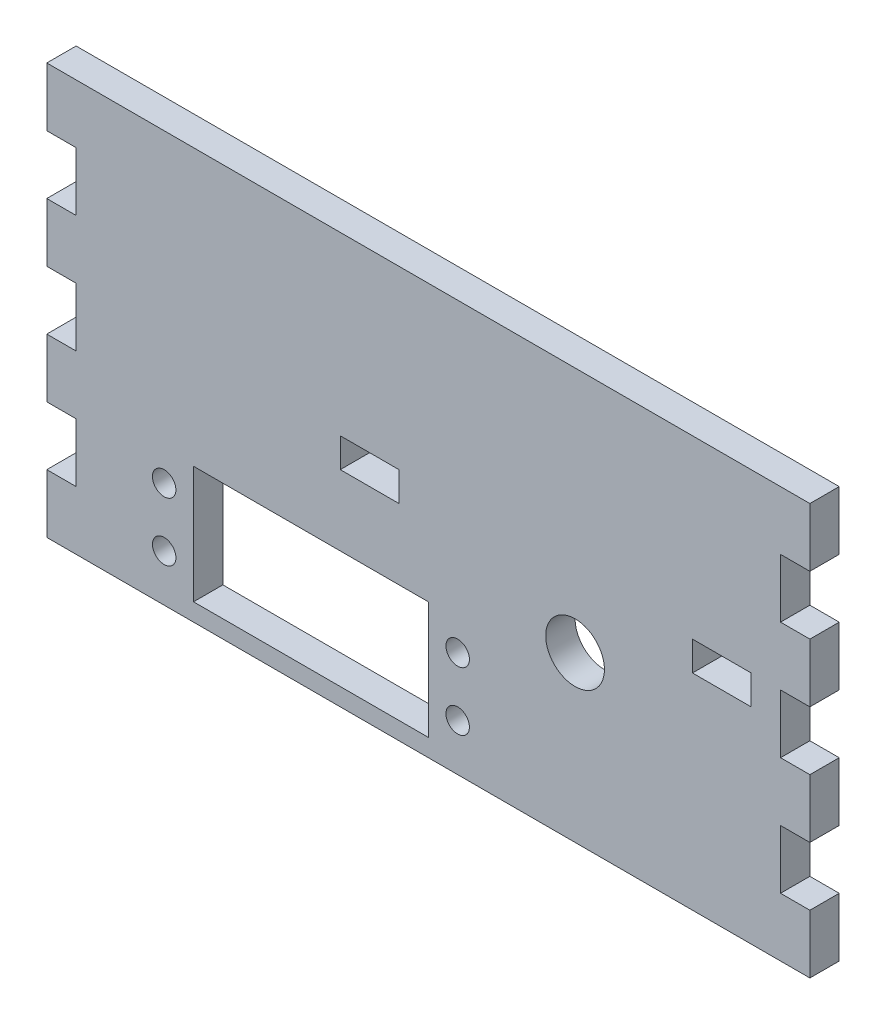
SolidWorks part; units mm, degrees
ref_plane "Plan de face" through (0, 0, 0) normal (0, 0, 1) x (1, 0, 0)
ref_plane "Plan de dessus" through (0, 0, 0) normal (0, 1, 0) x (1, 0, 0)
ref_plane "Plan de droite" through (0, 0, 0) normal (1, 0, 0) x (0, 0, -1)
sketch "Esquisse1" plane through (0, 0, 0) normal (0, 0, 1) x (1, 0, 0)
  line L1 (-45, 35) -> (75, 35)
  line L2 (-45, 35) -> (-45, -35)
  line L3 (-45, -35) -> (75, -35)
  line L4 (75, 35) -> (75, -35)
  line L5 (0, 0) -> (10, 0)
  line L6 (0, 0) -> (0, 5)
  line L7 (0, 5) -> (10, 5)
  line L8 (10, 0) -> (10, 5)
  line L9 (60, 5) -> (70, 5)
  line L10 (60, 5) -> (60, 0)
  line L11 (60, 0) -> (70, 0)
  line L12 (70, 5) -> (70, 0)
  dimension "D1" = 10
  dimension "D2" = 5
  dimension "D3" = 10
  dimension "D4" = 5
  dimension "D5" = 70
  dimension "D6" = 75
  dimension "D7" = 120
  dimension "D8" = 35
  dimension "D9" = 70
extrude "Boss.-Extru.1" add sketch "Esquisse1" along normal blind 5
sketch "Esquisse2" plane through (0, 0, 5) normal (0, 0, 1) x (1, 0, 0)
  line L0 (0, 5) -> (0, 0) construction
  line L1 (-45, -35) -> (75, -35) construction
  circle A0 centre (40, -7) radius 5
  dimension "D2" = 10
  dimension "D3" = 28
  dimension "D1" = 40
extrude "Enlèv. mat.-Extru.1" cut sketch "Esquisse2" against normal blind 5
sketch "Esquisse3" plane through (0, 0, 5) normal (0, 0, 1) x (1, 0, 0)
  line L1 (-25, -12) -> (15, -12)
  line L2 (-25, -12) -> (-25, -32)
  line L3 (-25, -32) -> (15, -32)
  line L4 (15, -12) -> (15, -32)
  dimension "D1" = 20
  dimension "D2" = 40
  dimension "D3" = 25
  dimension "D4" = 12
extrude "Enlèv. mat.-Extru.2" cut sketch "Esquisse3" against normal blind 10
sketch "Esquisse4" plane through (75, 0, 0) normal (1, 0, 0) x (0, 0, -1)
  line L0 (0, -35) -> (0, 35) construction
  line L1 (-5, -35) -> (0, -35)
  line L2 (-5, -35) -> (-5, -25)
  line L3 (-5, -25) -> (0, -25)
  line L4 (0, -35) -> (0, -25)
  line L5 (-5, -5) -> (0, -5)
  line L6 (-5, -15) -> (-5, -5)
  line L7 (0, -15) -> (0, -5)
  line L8 (-5, -15) -> (0, -15)
  line L9 (-5, 15) -> (0, 15)
  line L10 (-5, 5) -> (-5, 15)
  line L11 (0, 5) -> (0, 15)
  line L12 (-5, 5) -> (0, 5)
  line L13 (-5, 35) -> (0, 35)
  line L14 (-5, 25) -> (-5, 35)
  line L15 (0, 25) -> (0, 35)
  line L16 (-5, 25) -> (0, 25)
  dimension "D1" = 10
  dimension "D2" = 4
extrude "Boss.-Extru.2" add sketch "Esquisse4" along normal blind 5
sketch "Esquisse5" plane through (-45, 0, 0) normal (-1, 0, 0) x (0, 0, 1)
  line L0 (5, 25) -> (0, 25) construction
  line L1 (0, 25) -> (0, 35) construction
  line L2 (0, 35) -> (5, 35) construction
  line L3 (5, 35) -> (5, 25) construction
  line L4 (5, 5) -> (0, 5) construction
  line L5 (0, 5) -> (0, 15) construction
  line L6 (0, 15) -> (5, 15) construction
  line L7 (5, 15) -> (5, 5) construction
  line L8 (5, -15) -> (0, -15) construction
  line L9 (0, -15) -> (0, -5) construction
  line L10 (0, -5) -> (5, -5) construction
  line L11 (5, -5) -> (5, -15) construction
  line L12 (5, -25) -> (5, -35) construction
  line L13 (5, -35) -> (0, -35) construction
  line L14 (0, -35) -> (0, -25) construction
  line L15 (0, -25) -> (5, -25) construction
  line L16 (5, 25) -> (0, 25)
  line L17 (0, 25) -> (0, 35)
  line L18 (0, 35) -> (5, 35)
  line L19 (5, 35) -> (5, 25)
  line L20 (5, 5) -> (0, 5)
  line L21 (0, 5) -> (0, 15)
  line L22 (0, 15) -> (5, 15)
  line L23 (5, 15) -> (5, 5)
  line L24 (5, -15) -> (0, -15)
  line L25 (0, -15) -> (0, -5)
  line L26 (0, -5) -> (5, -5)
  line L27 (5, -5) -> (5, -15)
  line L28 (5, -25) -> (5, -35)
  line L29 (5, -35) -> (0, -35)
  line L30 (0, -35) -> (0, -25)
  line L31 (0, -25) -> (5, -25)
extrude "Boss.-Extru.3" add sketch "Esquisse5" along normal blind 5
sketch "Esquisse6" plane through (0, 0, 5) normal (0, 0, 1) x (1, 0, 0)
  circle A0 centre (-30, -27) radius 2 construction
  circle A2 centre (-30, -27) radius 2
  circle A3 centre (-30, -17) radius 2 construction
  circle A4 centre (20, -27) radius 2 construction
  circle A5 centre (20, -17) radius 2 construction
  circle A6 centre (-30, -17) radius 2
  circle A7 centre (20, -27) radius 2
  circle A8 centre (20, -17) radius 2
extrude "Enlèv. mat.-Extru.3" cut sketch "Esquisse6" against normal blind 10
